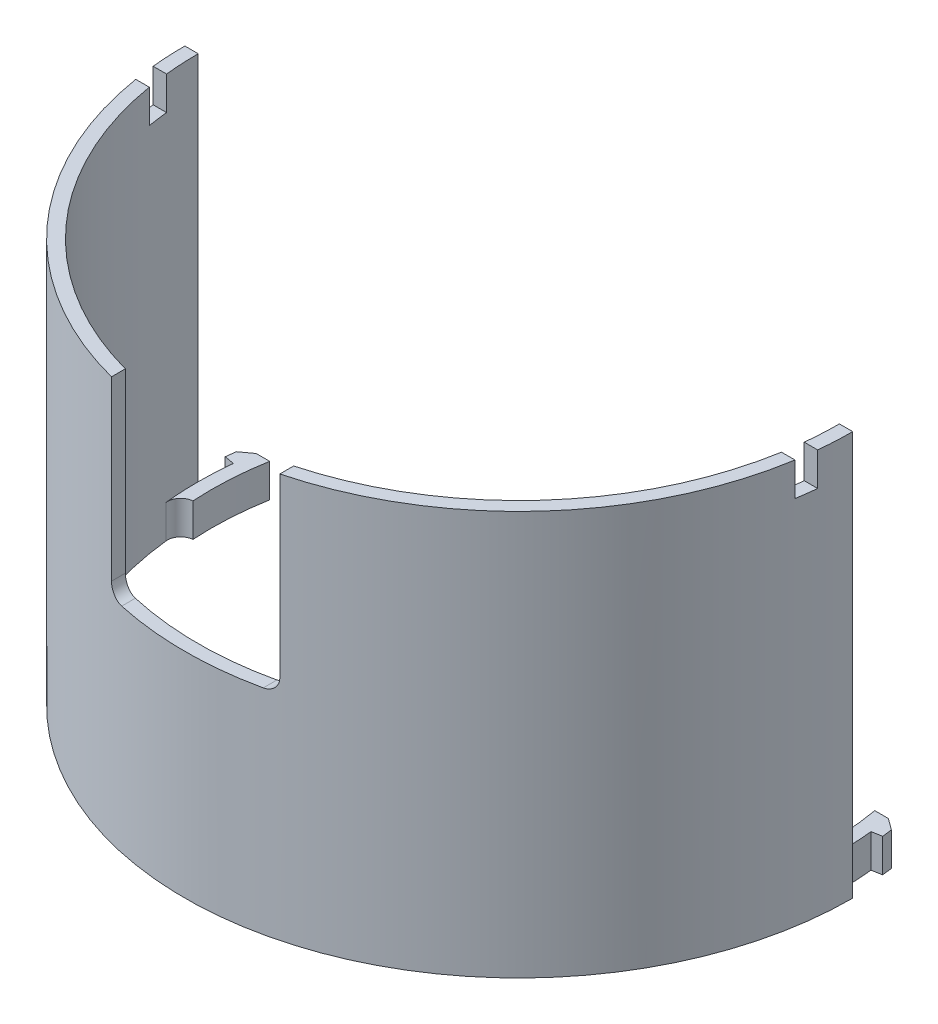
SolidWorks part; units mm, degrees
ref_plane "Front Plane" through (0, 0, 0) normal (0, 0, 1) x (1, 0, 0)
ref_plane "Top Plane" through (0, 0, 0) normal (0, 1, 0) x (1, 0, 0)
ref_plane "Right Plane" through (0, 0, 0) normal (1, 0, 0) x (0, 0, -1)
sketch "Sketch1" plane through (0, 0, 0) normal (0, 1, 0) x (1, 0, 0)
  line L0 (-50, 0) -> (-48, 0)
  line L1 (48, 0) -> (50, 0)
  arc A0 (-50, 0) -> (50, 0) centre (0, 0) ccw
  arc A1 (-48, 0) -> (48, 0) centre (0, 0) ccw
  dimension "D1" = 100
  dimension "D2" = 2
extrude "Shell Body" add sketch "Sketch1" along normal blind 60.5
sketch "Sketch3" plane through (0, 60.5, 0) normal (0, 1, 0) x (1, 0, 0)
  line L0 (0, 0) -> (0, -50) construction
  line L1 (-50, 0) -> (0, 0) construction
  line L2 (47.3286, -5) -> (47.3286, -8)
  line L3 (-49.7494, -5) -> (-47.3286, -5)
  line L4 (-49.7494, -5) -> (-49.7494, -8)
  line L5 (-49.7494, -8) -> (-47.3286, -8)
  line L6 (-47.3286, -5) -> (-47.3286, -8)
  line L7 (49.7494, -8) -> (47.3286, -8)
  line L8 (49.7494, -5) -> (49.7494, -8)
  line L9 (49.7494, -5) -> (47.3286, -5)
  arc A0 (-50, 0) -> (50, 0) centre (0, 0) ccw construction
  arc A1 (-48, 0) -> (48, 0) centre (0, 0) ccw construction
  dimension "D1" = 3
  dimension "D2" = 5
extrude "Clip Cavity" cut sketch "Sketch3" against normal blind 5
sketch "Sketch4" plane through (0, 0, 0) normal (0, -1, 0) x (1, 0, 0)
  line L0 (0, 0) -> (0, 27.6192) construction
  line L1 (0, 0) -> (48, 0) construction
  line L2 (47.7389, -5) -> (0, 0) construction
  line L3 (47.9062, 3) -> (0, 0) construction
  line L4 (45.299, -8) -> (47.3286, -8)
  line L5 (47.3286, -8) -> (49.0376, -6.75)
  line L6 (49.0376, -6.75) -> (49.2196, -5.2611)
  line L7 (49.2196, -5.2611) -> (47.7389, -5)
  line L8 (47.9062, 3) -> (45.9101, 2.875)
  line L9 (50, 0) -> (48, 0) construction
  line L10 (-47.9062, 3) -> (-45.9101, 2.875)
  line L11 (-45.299, -8) -> (-47.3286, -8)
  line L12 (-47.3286, -8) -> (-49.0376, -6.75)
  line L13 (-49.2196, -5.2611) -> (-47.7389, -5)
  line L14 (-49.0376, -6.75) -> (-49.2196, -5.2611)
  arc A0 (47.9062, 3) -> (47.7389, -5) centre (0, 0) cw
  arc A1 (48, 0) -> (-48, 0) centre (0, 0) ccw construction
  arc A2 (45.9101, 2.875) -> (45.7498, -4.7917) centre (0, 0) cw
  arc A3 (45.7498, -4.7917) -> (45.299, -8) centre (0, 0) cw
  arc A4 (47.7389, -5) -> (43.7237, -19.8049) centre (0, 0) cw construction
  arc A5 (49.5, 0) -> (45.2081, -20.1614) centre (0, 0) cw construction
  arc A6 (-45.9101, 2.875) -> (-45.7498, -4.7917) centre (0, 0) ccw
  arc A7 (-47.9062, 3) -> (-47.7389, -5) centre (0, 0) ccw
  arc A8 (-45.7498, -4.7917) -> (-45.299, -8) centre (0, 0) ccw
  dimension "D1" = 2
  dimension "D4" = 3
  dimension "D5" = 1.5
  dimension "D2" = 3
  dimension "D3" = 5
  dimension "D6" = 1.5
  dimension "D7" = 1.25
extrude "Clip" add sketch "Sketch4" against normal blind 5
sketch "Sketch5" plane through (0, 0, 0) normal (0, -1, 0) x (1, 0, 0)
  line L0 (0, 0) -> (0, 50) construction
  line L1 (16, 45.2548) -> (16, 36)
  line L2 (16, 36) -> (12, 36)
  line L3 (-12, 36) -> (-16, 36)
  line L4 (-16, 45.2548) -> (-16, 36)
  arc A0 (50, 0) -> (-50, 0) centre (0, 0) ccw construction
  arc A1 (47.9062, 3) -> (-47.9062, 3) centre (0, 0) ccw construction
  arc A2 (47.9062, 3) -> (-47.9062, 3) centre (0, 0) ccw construction
  arc A3 (16, 45.2548) -> (-16, 45.2548) centre (0, 0) ccw
  arc A6 (12, 36) -> (-12, 36) centre (0, 33) ccw
  point P11 (0, 48)
  point P18 (-16, 36)
  point P21 (16, 36)
  dimension "D1" = 32
  dimension "D2" = 12
  dimension "D6" = 3
  dimension "D4" = 4
  dimension "D5" = 4
extrude "Top Clamp" add sketch "Sketch5" against normal blind 5
sketch "Sketch6" plane through (0, 60.5, 0) normal (0, 1, 0) x (1, 0, 0)
  line L0 (0, 0) -> (0, -50) construction
  line L2 (-12.6, -46.3167) -> (12.6, -46.3167)
  line L3 (-12.6, -46.3167) -> (-12.6, -50)
  line L4 (-12.6, -50) -> (12.6, -50)
  line L5 (12.6, -46.3167) -> (12.6, -50)
  arc A0 (-49.3559, -8) -> (49.3559, -8) centre (0, 0) ccw construction
  arc A1 (-47.3286, -8) -> (47.3286, -8) centre (0, 0) ccw construction
  dimension "D1" = 25.2
extrude "Fan Clearance" cut sketch "Sketch6" against normal blind 28.5
fillet "Shell Fillet" radius 2 6 edges at (47.9062, 2.5, 3) (-47.9062, 2.5, 3) (-12.6, 32, 47.3515) (12.6, 32, 47.3515) (-16, 2.5, 36) (16, 2.5, 36)
ref_point "Ref Center"
equation "\"D1@Sketch1\"=\"base diameter@values@params.sldprt\""
